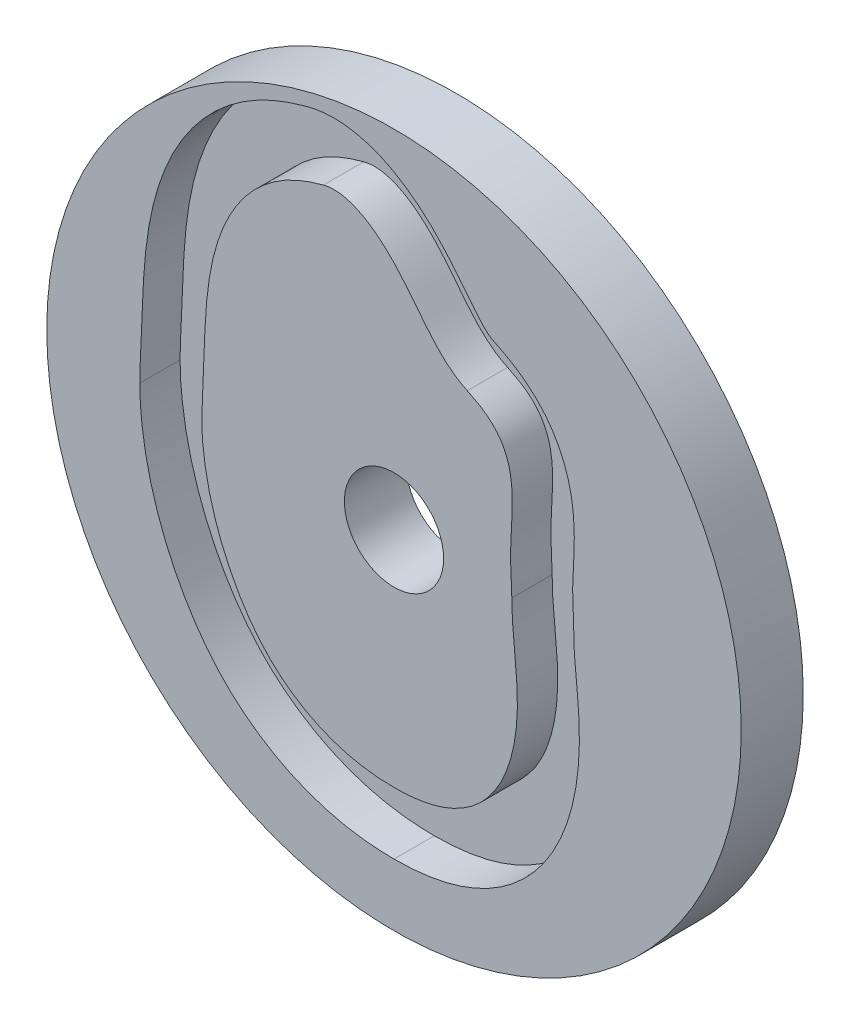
SolidWorks part; units mm, degrees
ref_plane "Front" through (0, 0, 0) normal (0, 0, 1) x (1, 0, 0)
ref_plane "Top" through (0, 0, 0) normal (0, 1, 0) x (1, 0, 0)
ref_plane "Right" through (0, 0, 0) normal (1, 0, 0) x (0, 0, -1)
sketch "Sketch1" plane through (0, 0, 0) normal (0, 0, 1) x (1, 0, 0)
  circle A0 centre (0, 0) radius 177.8
  circle A1 centre (0, 0) radius 25.4
  dimension "D1" = 355.6
  dimension "D2" = 50.8
extrude "Extrude1" add sketch "Sketch1" against normal blind 31.75
sketch "Profile1Sketch" plane through (0, 0, 0) normal (0, 0, 1) x (1, 0, 0)
  line L0 (92.075, 0) -> (60.325, 0)
  line L1 (50.947, 109.2563) -> (37.5289, 80.481)
  point P2 (92.0595, 1.738)
  point P3 (92.023, 3.2668)
  point P4 (91.9714, 4.7476)
  point P5 (91.9097, 6.1821)
  point P6 (91.8427, 7.5727)
  point P7 (91.7742, 8.9228)
  point P8 (91.7078, 10.2366)
  point P9 (91.646, 11.519)
  point P10 (91.5912, 12.776)
  point P11 (91.545, 14.0138)
  point P12 (91.5088, 15.2398)
  point P13 (91.4836, 16.4613)
  point P14 (91.4702, 17.6861)
  point P15 (91.4691, 18.9222)
  point P16 (91.4806, 20.1771)
  point P17 (91.5048, 21.4582)
  point P18 (91.5414, 22.7723)
  point P19 (91.5899, 24.1255)
  point P20 (91.6495, 25.523)
  point P21 (91.7188, 26.9694)
  point P22 (91.796, 28.4683)
  point P23 (91.8788, 30.0225)
  point P24 (91.9644, 31.6339)
  point P25 (92.0495, 33.3038)
  point P26 (92.1301, 35.0326)
  point P27 (92.2021, 36.8201)
  point P28 (92.2607, 38.6657)
  point P29 (92.301, 40.5678)
  point P30 (92.3175, 42.5247)
  point P31 (92.3048, 44.5339)
  point P32 (92.2571, 46.5927)
  point P33 (92.1687, 48.6978)
  point P34 (92.0337, 50.8454)
  point P35 (91.8464, 53.0315)
  point P36 (91.6011, 55.2515)
  point P37 (91.2924, 57.5005)
  point P38 (90.915, 59.7731)
  point P39 (90.4641, 62.0638)
  point P40 (89.9352, 64.3665)
  point P41 (89.3244, 66.6748)
  point P42 (88.6282, 68.9821)
  point P43 (87.844, 71.2815)
  point P44 (86.9695, 73.5658)
  point P45 (86.0037, 75.8279)
  point P46 (84.9462, 78.0604)
  point P47 (83.7975, 80.2562)
  point P48 (82.559, 82.4083)
  point P49 (81.2332, 84.5098)
  point P50 (79.8234, 86.5546)
  point P51 (78.3338, 88.5367)
  point P52 (76.7695, 90.4513)
  point P53 (75.1363, 92.2938)
  point P54 (73.4405, 94.0609)
  point P55 (71.6889, 95.75)
  point P56 (69.8887, 97.3596)
  point P57 (68.0473, 98.8889)
  point P58 (66.1719, 100.3383)
  point P59 (64.27, 101.7089)
  point P60 (62.3485, 103.0028)
  point P61 (60.4143, 104.2226)
  point P62 (58.4738, 105.3717)
  point P63 (56.5327, 106.4539)
  point P64 (54.5964, 107.4738)
  point P65 (52.6697, 108.4358)
  point P67 (60.3142, 1.1877)
  point P68 (60.2872, 2.3181)
  point P69 (60.246, 3.4962)
  point P70 (60.1933, 4.7208)
  point P71 (60.1321, 5.9907)
  point P72 (60.0655, 7.3042)
  point P73 (59.997, 8.6592)
  point P74 (59.9298, 10.0534)
  point P75 (59.8675, 11.4838)
  point P76 (59.8129, 12.9471)
  point P77 (59.7689, 14.4397)
  point P78 (59.7376, 15.9578)
  point P79 (59.7208, 17.4971)
  point P80 (59.7194, 19.0538)
  point P81 (59.7338, 20.6237)
  point P82 (59.7635, 22.2031)
  point P83 (59.8076, 23.7887)
  point P84 (59.8646, 25.3775)
  point P85 (59.9323, 26.9669)
  point P86 (60.0084, 28.5548)
  point P87 (60.09, 30.1396)
  point P88 (60.1742, 31.7198)
  point P89 (60.2579, 33.2944)
  point P90 (60.3378, 34.8623)
  point P91 (60.4106, 36.4227)
  point P92 (60.4731, 37.9747)
  point P93 (60.5222, 39.5173)
  point P94 (60.5546, 41.0495)
  point P95 (60.5675, 42.57)
  point P96 (60.558, 44.0775)
  point P97 (60.5235, 45.5704)
  point P98 (60.4616, 47.047)
  point P99 (60.37, 48.5053)
  point P100 (60.2469, 49.9434)
  point P101 (60.0906, 51.3592)
  point P102 (59.8997, 52.7506)
  point P103 (59.6731, 54.1157)
  point P104 (59.4101, 55.4525)
  point P105 (59.11, 56.7593)
  point P106 (58.7727, 58.0345)
  point P107 (58.3979, 59.277)
  point P108 (57.9857, 60.4858)
  point P109 (57.5362, 61.6603)
  point P110 (57.0495, 62.8004)
  point P111 (56.5257, 63.9062)
  point P112 (55.9649, 64.9784)
  point P113 (55.3669, 66.0176)
  point P114 (54.7313, 67.0251)
  point P115 (54.0578, 68.002)
  point P116 (53.3455, 68.9499)
  point P117 (52.5935, 69.8701)
  point P118 (51.8009, 70.7643)
  point P119 (50.9665, 71.6337)
  point P120 (50.0891, 72.4797)
  point P121 (49.1675, 73.3035)
  point P122 (48.2007, 74.1063)
  point P123 (47.1877, 74.8891)
  point P124 (46.1279, 75.6527)
  point P125 (45.0207, 76.3981)
  point P126 (43.8659, 77.1263)
  point P127 (42.6635, 77.8381)
  point P128 (41.4138, 78.5348)
  point P129 (40.1174, 79.2174)
  point P130 (38.7752, 79.8874)
extrude "Cycloidal  0.0  65.0  76.200  104.676" cut sketch "Profile1Sketch" against normal blind 20.6502
sketch "Profile2Sketch" plane through (0, 0, 0) normal (0, 0, 1) x (1, 0, 0)
  line L0 (50.947, 109.2563) -> (37.5289, 80.481)
  line L1 (-44.3489, 165.5123) -> (-36.1314, 134.8442)
  point P2 (50.2105, 109.6342)
  point P3 (49.5194, 110.0527)
  point P4 (48.7756, 110.5706)
  point P5 (47.9577, 111.2146)
  point P6 (47.0537, 112.0067)
  point P7 (46.0586, 112.9626)
  point P8 (44.9718, 114.0908)
  point P9 (43.795, 115.3931)
  point P10 (42.5301, 116.8661)
  point P11 (41.1785, 118.5021)
  point P12 (39.7405, 120.2904)
  point P13 (38.2155, 122.2182)
  point P14 (36.6019, 124.2711)
  point P15 (34.8971, 126.4338)
  point P16 (33.0983, 128.6904)
  point P17 (31.2021, 131.0244)
  point P18 (29.2052, 133.4189)
  point P19 (27.1043, 135.857)
  point P20 (24.8963, 138.3214)
  point P21 (22.5783, 140.7948)
  point P22 (20.148, 143.2597)
  point P23 (17.6035, 145.6987)
  point P24 (14.9434, 148.0943)
  point P25 (12.167, 150.4289)
  point P26 (9.274, 152.6849)
  point P27 (6.2651, 154.8448)
  point P28 (3.1416, 156.8909)
  point P29 (-0.0942, 158.8054)
  point P30 (-3.4388, 160.5706)
  point P31 (-6.8878, 162.1685)
  point P32 (-10.435, 163.5815)
  point P33 (-14.0726, 164.7919)
  point P34 (-17.7906, 165.7824)
  point P35 (-21.5767, 166.5366)
  point P36 (-25.4162, 167.0393)
  point P37 (-29.2917, 167.2769)
  point P38 (-33.1832, 167.2386)
  point P39 (-37.0686, 166.9165)
  point P40 (-40.9243, 166.3068)
  point P42 (34.6835, 81.9398)
  point P43 (32.2127, 83.4343)
  point P44 (29.8689, 85.0638)
  point P45 (27.6576, 86.8022)
  point P46 (25.5741, 88.6253)
  point P47 (23.6068, 90.5131)
  point P48 (21.7392, 92.4504)
  point P49 (19.9529, 94.4261)
  point P50 (18.2295, 96.4323)
  point P51 (16.5514, 98.4629)
  point P52 (14.9028, 100.5129)
  point P53 (13.2695, 102.5774)
  point P54 (11.6396, 104.6511)
  point P55 (10.0027, 106.7277)
  point P56 (8.3505, 108.8005)
  point P57 (6.6762, 110.8615)
  point P58 (4.9746, 112.9021)
  point P59 (3.2422, 114.9128)
  point P60 (1.4766, 116.8836)
  point P61 (-0.3229, 118.8039)
  point P62 (-2.1556, 120.663)
  point P63 (-4.0197, 122.4501)
  point P64 (-5.912, 124.1545)
  point P65 (-7.8282, 125.766)
  point P66 (-9.7626, 127.2749)
  point P67 (-11.7089, 128.6723)
  point P68 (-13.6596, 129.9505)
  point P69 (-15.6067, 131.103)
  point P70 (-17.5418, 132.1247)
  point P71 (-19.4563, 133.0121)
  point P72 (-21.342, 133.7637)
  point P73 (-23.1912, 134.3795)
  point P74 (-24.9974, 134.8612)
  point P75 (-26.7556, 135.2119)
  point P76 (-28.4628, 135.4358)
  point P77 (-30.1182, 135.5376)
  point P78 (-31.7231, 135.5221)
  point P79 (-33.2811, 135.3933)
  point P80 (-34.7973, 135.1536)
extrude "Harmonic  65.0  105.0  104.676  155.476" cut sketch "Profile2Sketch" against normal blind 20.6502
sketch "Profile3Sketch" plane through (0, 0, 0) normal (0, 0, 1) x (1, 0, 0)
  line L0 (-44.3489, 165.5123) -> (-36.1314, 134.8442)
  line L1 (-130.175, 0) -> (-98.425, 0)
  point P2 (-47.5406, 164.6224)
  point P3 (-50.4636, 163.7405)
  point P4 (-53.4011, 162.7814)
  point P5 (-56.346, 161.7382)
  point P6 (-59.29, 160.6053)
  point P7 (-62.224, 159.3786)
  point P8 (-65.1381, 158.0555)
  point P9 (-68.0223, 156.6354)
  point P10 (-70.8668, 155.1198)
  point P11 (-73.6623, 153.5115)
  point P12 (-76.4038, 151.8139)
  point P13 (-79.0875, 150.0291)
  point P14 (-81.7102, 148.1595)
  point P15 (-84.2689, 146.2081)
  point P16 (-86.7606, 144.1779)
  point P17 (-89.1826, 142.072)
  point P18 (-91.5327, 139.8941)
  point P19 (-93.8085, 137.6476)
  point P20 (-96.0083, 135.3364)
  point P21 (-98.1303, 132.9645)
  point P22 (-100.1733, 130.5357)
  point P23 (-102.1361, 128.0543)
  point P24 (-104.0178, 125.5245)
  point P25 (-105.8181, 122.9504)
  point P26 (-107.5365, 120.3365)
  point P27 (-109.1732, 117.6869)
  point P28 (-110.7283, 115.006)
  point P29 (-112.2024, 112.298)
  point P30 (-113.5964, 109.5672)
  point P31 (-114.9111, 106.8177)
  point P32 (-116.1479, 104.0536)
  point P33 (-117.3083, 101.279)
  point P34 (-118.3939, 98.4977)
  point P35 (-119.4066, 95.7135)
  point P36 (-120.3486, 92.9302)
  point P37 (-121.222, 90.1511)
  point P38 (-122.0292, 87.3798)
  point P39 (-122.7729, 84.6194)
  point P40 (-123.4557, 81.873)
  point P41 (-124.0805, 79.1435)
  point P42 (-124.65, 76.4336)
  point P43 (-125.1673, 73.7457)
  point P44 (-125.6355, 71.0822)
  point P45 (-126.0576, 68.4453)
  point P46 (-126.4367, 65.8367)
  point P47 (-126.7761, 63.2582)
  point P48 (-127.0787, 60.7112)
  point P49 (-127.3479, 58.197)
  point P50 (-127.5865, 55.7165)
  point P51 (-127.7977, 53.2706)
  point P52 (-127.9845, 50.8597)
  point P53 (-128.1496, 48.4841)
  point P54 (-128.2959, 46.1439)
  point P55 (-128.4259, 43.8389)
  point P56 (-128.5423, 41.5686)
  point P57 (-128.6475, 39.3323)
  point P58 (-128.7435, 37.129)
  point P59 (-128.8326, 34.9576)
  point P60 (-128.9166, 32.8165)
  point P61 (-128.9973, 30.704)
  point P62 (-129.0763, 28.6183)
  point P63 (-129.1548, 26.5571)
  point P64 (-129.2342, 24.5182)
  point P65 (-129.3155, 22.4989)
  point P66 (-129.3995, 20.4966)
  point P67 (-129.4866, 18.5083)
  point P68 (-129.578, 16.5273)
  point P69 (-129.673, 14.5428)
  point P70 (-129.7704, 12.5438)
  point P71 (-129.8677, 10.5204)
  point P72 (-129.9609, 8.4634)
  point P73 (-130.0451, 6.3653)
  point P74 (-130.114, 4.2198)
  point P75 (-130.1601, 2.023)
  point P77 (-38.6901, 134.1309)
  point P78 (-40.9627, 133.4454)
  point P79 (-43.1837, 132.7203)
  point P80 (-45.3533, 131.9519)
  point P81 (-47.4723, 131.1366)
  point P82 (-49.5425, 130.2711)
  point P83 (-51.5662, 129.3524)
  point P84 (-53.5461, 128.3777)
  point P85 (-55.4855, 127.3443)
  point P86 (-57.3875, 126.2499)
  point P87 (-59.2525, 125.095)
  point P88 (-61.079, 123.8803)
  point P89 (-62.8655, 122.6068)
  point P90 (-64.6108, 121.2758)
  point P91 (-66.3133, 119.8885)
  point P92 (-67.9721, 118.4463)
  point P93 (-69.5858, 116.9508)
  point P94 (-71.1533, 115.4034)
  point P95 (-72.6738, 113.8059)
  point P96 (-74.1461, 112.1602)
  point P97 (-75.5695, 110.4679)
  point P98 (-76.9433, 108.7311)
  point P99 (-78.2668, 106.9517)
  point P100 (-79.5395, 105.132)
  point P101 (-80.7609, 103.2739)
  point P102 (-81.9309, 101.3798)
  point P103 (-83.0492, 99.4519)
  point P104 (-84.1159, 97.4923)
  point P105 (-85.131, 95.5036)
  point P106 (-86.0949, 93.4878)
  point P107 (-87.0078, 91.4475)
  point P108 (-87.8704, 89.3848)
  point P109 (-88.6833, 87.302)
  point P110 (-89.4473, 85.2014)
  point P111 (-90.1635, 83.0852)
  point P112 (-90.8328, 80.9555)
  point P113 (-91.4565, 78.8143)
  point P114 (-92.0359, 76.6636)
  point P115 (-92.5724, 74.5053)
  point P116 (-93.0677, 72.3412)
  point P117 (-93.5234, 70.1729)
  point P118 (-93.9412, 68.0019)
  point P119 (-94.3229, 65.8298)
  point P120 (-94.6706, 63.6578)
  point P121 (-94.9861, 61.4871)
  point P122 (-95.2714, 59.3186)
  point P123 (-95.5287, 57.1534)
  point P124 (-95.76, 54.9921)
  point P125 (-95.9675, 52.8355)
  point P126 (-96.1533, 50.684)
  point P127 (-96.3195, 48.5382)
  point P128 (-96.4682, 46.3982)
  point P129 (-96.6016, 44.2642)
  point P130 (-96.7216, 42.1366)
  point P131 (-96.8304, 40.0151)
  point P132 (-96.9298, 37.9)
  point P133 (-97.0217, 35.7911)
  point P134 (-97.108, 33.6884)
  point P135 (-97.1903, 31.5918)
  point P136 (-97.2701, 29.5011)
  point P137 (-97.349, 27.4163)
  point P138 (-97.4283, 25.3373)
  point P139 (-97.509, 23.2641)
  point P140 (-97.5922, 21.1966)
  point P141 (-97.6788, 19.1349)
  point P142 (-97.7688, 17.0789)
  point P143 (-97.8632, 15.0327)
  point P144 (-97.9603, 13.0039)
  point P145 (-98.058, 10.9999)
  point P146 (-98.1528, 9.0278)
  point P147 (-98.2405, 7.0938)
  point P148 (-98.3164, 5.203)
  point P149 (-98.3756, 3.36)
  point P150 (-98.4133, 1.5677)
extrude "Sine(Mod)  105.0  180.0  155.476  114.300" cut sketch "Profile3Sketch" against normal blind 20.6502
sketch "Profile4Sketch" plane through (0, 0, 0) normal (0, 0, 1) x (1, 0, 0)
  line L0 (-130.175, 0) -> (-98.425, 0)
  line L1 (0, -145.9509) -> (0, -114.2009)
  point P2 (-130.1514, -2.4925)
  point P3 (-130.0905, -4.7469)
  point P4 (-129.9937, -6.99)
  point P5 (-129.8628, -9.2219)
  point P6 (-129.6994, -11.4429)
  point P7 (-129.5048, -13.6538)
  point P8 (-129.2802, -15.8554)
  point P9 (-129.0266, -18.0488)
  point P10 (-128.7445, -20.2351)
  point P11 (-128.4346, -22.4156)
  point P12 (-128.0968, -24.5918)
  point P13 (-127.731, -26.7647)
  point P14 (-127.3373, -28.9345)
  point P15 (-126.9157, -31.1013)
  point P16 (-126.466, -33.2648)
  point P17 (-125.9882, -35.4249)
  point P18 (-125.4821, -37.5814)
  point P19 (-124.9478, -39.7342)
  point P20 (-124.3851, -41.8832)
  point P21 (-123.7939, -44.028)
  point P22 (-123.1741, -46.1687)
  point P23 (-122.5257, -48.305)
  point P24 (-121.8485, -50.4367)
  point P25 (-121.1425, -52.5636)
  point P26 (-120.4074, -54.6856)
  point P27 (-119.6432, -56.8024)
  point P28 (-118.8497, -58.9139)
  point P29 (-118.0269, -61.0197)
  point P30 (-117.1745, -63.1197)
  point P31 (-116.2925, -65.2136)
  point P32 (-115.3807, -67.3012)
  point P33 (-114.439, -69.3823)
  point P34 (-113.4671, -71.4565)
  point P35 (-112.4651, -73.5237)
  point P36 (-111.4324, -75.5839)
  point P37 (-110.3681, -77.638)
  point P38 (-109.2711, -79.6865)
  point P39 (-108.1402, -81.7297)
  point P40 (-106.974, -83.7679)
  point P41 (-105.771, -85.8006)
  point P42 (-104.5299, -87.8275)
  point P43 (-103.2491, -89.8476)
  point P44 (-101.9272, -91.8598)
  point P45 (-100.5627, -93.8626)
  point P46 (-99.1546, -95.8544)
  point P47 (-97.7017, -97.8331)
  point P48 (-96.2031, -99.7965)
  point P49 (-94.6582, -101.7422)
  point P50 (-93.0666, -103.6677)
  point P51 (-91.428, -105.5703)
  point P52 (-89.7426, -107.4474)
  point P53 (-88.011, -109.2961)
  point P54 (-86.2338, -111.1139)
  point P55 (-84.4121, -112.8983)
  point P56 (-82.5471, -114.6468)
  point P57 (-80.6405, -116.3571)
  point P58 (-78.694, -118.0275)
  point P59 (-76.7088, -119.6568)
  point P60 (-74.6858, -121.2439)
  point P61 (-72.6262, -122.7881)
  point P62 (-70.5309, -124.2885)
  point P63 (-68.4009, -125.7442)
  point P64 (-66.2374, -127.1545)
  point P65 (-64.0414, -128.5185)
  point P66 (-61.814, -129.8354)
  point P67 (-59.5564, -131.1046)
  point P68 (-57.2697, -132.3253)
  point P69 (-54.9551, -133.4969)
  point P70 (-52.6137, -134.6187)
  point P71 (-50.2467, -135.69)
  point P72 (-47.8553, -136.7104)
  point P73 (-45.4408, -137.6791)
  point P74 (-43.0043, -138.5958)
  point P75 (-40.5472, -139.4597)
  point P76 (-38.0706, -140.2706)
  point P77 (-35.5758, -141.028)
  point P78 (-33.0641, -141.7313)
  point P79 (-30.5368, -142.3803)
  point P80 (-27.9951, -142.9746)
  point P81 (-25.441, -143.5138)
  point P82 (-22.8768, -143.9975)
  point P83 (-20.3053, -144.4258)
  point P84 (-17.7289, -144.7989)
  point P85 (-15.1502, -145.1176)
  point P86 (-12.5715, -145.3826)
  point P87 (-9.9949, -145.5952)
  point P88 (-7.4224, -145.7567)
  point P89 (-4.8557, -145.8686)
  point P90 (-2.2963, -145.9327)
  point P92 (-98.407, -1.896)
  point P93 (-98.3601, -3.63)
  point P94 (-98.2849, -5.3731)
  point P95 (-98.1822, -7.1246)
  point P96 (-98.0528, -8.8834)
  point P97 (-97.8974, -10.6485)
  point P98 (-97.7168, -12.4185)
  point P99 (-97.5117, -14.1924)
  point P100 (-97.2825, -15.9686)
  point P101 (-97.0299, -17.7457)
  point P102 (-96.7541, -19.5222)
  point P103 (-96.4553, -21.2967)
  point P104 (-96.1339, -23.0688)
  point P105 (-95.7895, -24.8384)
  point P106 (-95.4223, -26.6052)
  point P107 (-95.0321, -28.3693)
  point P108 (-94.6188, -30.1305)
  point P109 (-94.1824, -31.8886)
  point P110 (-93.7229, -33.6435)
  point P111 (-93.2401, -35.3951)
  point P112 (-92.734, -37.1433)
  point P113 (-92.2044, -38.8879)
  point P114 (-91.6514, -40.6287)
  point P115 (-91.0748, -42.3657)
  point P116 (-90.4745, -44.0987)
  point P117 (-89.8504, -45.8274)
  point P118 (-89.2024, -47.5518)
  point P119 (-88.5304, -49.2716)
  point P120 (-87.8342, -50.9867)
  point P121 (-87.1138, -52.6969)
  point P122 (-86.3691, -54.402)
  point P123 (-85.5999, -56.1018)
  point P124 (-84.806, -57.7961)
  point P125 (-83.9876, -59.4848)
  point P126 (-83.1443, -61.1669)
  point P127 (-82.2769, -62.8411)
  point P128 (-81.3854, -64.5059)
  point P129 (-80.4701, -66.1596)
  point P130 (-79.5311, -67.8007)
  point P131 (-78.5684, -69.4276)
  point P132 (-77.5818, -71.0387)
  point P133 (-76.5713, -72.6326)
  point P134 (-75.5365, -74.2077)
  point P135 (-74.4771, -75.7628)
  point P136 (-73.3929, -77.2965)
  point P137 (-72.2834, -78.8076)
  point P138 (-71.1482, -80.295)
  point P139 (-69.9868, -81.7577)
  point P140 (-68.7988, -83.1948)
  point P141 (-67.5838, -84.6056)
  point P142 (-66.3413, -85.9896)
  point P143 (-65.0707, -87.346)
  point P144 (-63.7718, -88.6747)
  point P145 (-62.4439, -89.9753)
  point P146 (-61.0868, -91.2476)
  point P147 (-59.7001, -92.4917)
  point P148 (-58.2834, -93.7073)
  point P149 (-56.8374, -94.8941)
  point P150 (-55.3626, -96.0512)
  point P151 (-53.8599, -97.1778)
  point P152 (-52.3299, -98.2734)
  point P153 (-50.7735, -99.3371)
  point P154 (-49.1915, -100.3683)
  point P155 (-47.5847, -101.3663)
  point P156 (-45.9538, -102.3306)
  point P157 (-44.2999, -103.2604)
  point P158 (-42.6236, -104.1553)
  point P159 (-40.9259, -105.0146)
  point P160 (-39.2077, -105.8378)
  point P161 (-37.4699, -106.6243)
  point P162 (-35.7134, -107.3738)
  point P163 (-33.9391, -108.0857)
  point P164 (-32.1479, -108.7595)
  point P165 (-30.3409, -109.3949)
  point P166 (-28.519, -109.9914)
  point P167 (-26.6832, -110.5487)
  point P168 (-24.8343, -111.0665)
  point P169 (-22.9735, -111.5443)
  point P170 (-21.1018, -111.982)
  point P171 (-19.2195, -112.3793)
  point P172 (-17.3267, -112.7364)
  point P173 (-15.4229, -113.0534)
  point P174 (-13.5082, -113.3307)
  point P175 (-11.5824, -113.5687)
  point P176 (-9.6456, -113.7677)
  point P177 (-7.6977, -113.9284)
  point P178 (-5.7389, -114.0513)
  point P179 (-3.7696, -114.1372)
  point P180 (-1.79, -114.1867)
extrude "Trap(Mod)  180.0  270.0  114.300  130.076" cut sketch "Profile4Sketch" against normal blind 20.6502
sketch "Profile5Sketch" plane through (0, 0, 0) normal (0, 0, 1) x (1, 0, 0)
  line L0 (0, -145.9509) -> (0, -114.2009)
  line L1 (92.075, 0) -> (60.325, 0)
  point P2 (2.8128, -145.9233)
  point P3 (5.3875, -145.8475)
  point P4 (7.978, -145.7198)
  point P5 (10.5825, -145.5367)
  point P6 (13.1992, -145.2947)
  point P7 (15.826, -144.9905)
  point P8 (18.4605, -144.6207)
  point P9 (21.0999, -144.1822)
  point P10 (23.7413, -143.6721)
  point P11 (26.3814, -143.0876)
  point P12 (29.0168, -142.4262)
  point P13 (31.6439, -141.6857)
  point P14 (34.2587, -140.8642)
  point P15 (36.8572, -139.9602)
  point P16 (39.4353, -138.9724)
  point P17 (41.9887, -137.8999)
  point P18 (44.5131, -136.7424)
  point P19 (47.0041, -135.4998)
  point P20 (49.4574, -134.1726)
  point P21 (51.8686, -132.7614)
  point P22 (54.2337, -131.2676)
  point P23 (56.5484, -129.6928)
  point P24 (58.8089, -128.0391)
  point P25 (61.0115, -126.3088)
  point P26 (63.1528, -124.5048)
  point P27 (65.2294, -122.6302)
  point P28 (67.2386, -120.6885)
  point P29 (69.1777, -118.6833)
  point P30 (71.0444, -116.6187)
  point P31 (72.8369, -114.4988)
  point P32 (74.5536, -112.328)
  point P33 (76.1933, -110.1108)
  point P34 (77.7552, -107.8519)
  point P35 (79.2388, -105.5559)
  point P36 (80.6439, -103.2277)
  point P37 (81.9708, -100.8721)
  point P38 (83.2201, -98.4937)
  point P39 (84.3927, -96.0974)
  point P40 (85.4897, -93.6879)
  point P41 (86.5127, -91.2699)
  point P42 (87.4634, -88.8477)
  point P43 (88.3439, -86.4259)
  point P44 (89.1564, -84.0087)
  point P45 (89.9033, -81.6002)
  point P46 (90.5875, -79.2044)
  point P47 (91.2127, -76.8201)
  point P48 (91.7816, -74.4465)
  point P49 (92.2959, -72.086)
  point P50 (92.7574, -69.7408)
  point P51 (93.168, -67.4131)
  point P52 (93.5297, -65.1049)
  point P53 (93.8444, -62.8181)
  point P54 (94.1142, -60.5546)
  point P55 (94.3414, -58.3162)
  point P56 (94.528, -56.1045)
  point P57 (94.6763, -53.9211)
  point P58 (94.7887, -51.7674)
  point P59 (94.8674, -49.6447)
  point P60 (94.9148, -47.5542)
  point P61 (94.9332, -45.4972)
  point P62 (94.925, -43.4745)
  point P63 (94.8926, -41.4872)
  point P64 (94.8383, -39.536)
  point P65 (94.7645, -37.6215)
  point P66 (94.6735, -35.7444)
  point P67 (94.5676, -33.9051)
  point P68 (94.449, -32.1039)
  point P69 (94.32, -30.3411)
  point P70 (94.1827, -28.6168)
  point P71 (94.0391, -26.931)
  point P72 (93.8912, -25.2834)
  point P73 (93.7409, -23.6739)
  point P74 (93.59, -22.102)
  point P75 (93.4402, -20.5671)
  point P76 (93.293, -19.0685)
  point P77 (93.1499, -17.6053)
  point P78 (93.0122, -16.1764)
  point P79 (92.881, -14.7806)
  point P80 (92.7574, -13.4164)
  point P81 (92.6423, -12.0822)
  point P82 (92.5365, -10.7762)
  point P83 (92.4406, -9.4963)
  point P84 (92.3551, -8.2401)
  point P85 (92.2805, -7.0053)
  point P86 (92.2172, -5.7891)
  point P87 (92.1652, -4.5888)
  point P88 (92.125, -3.4012)
  point P89 (92.0965, -2.2233)
  point P90 (92.0798, -1.0517)
  point P92 (2.1815, -114.1795)
  point P93 (4.1451, -114.1218)
  point P94 (6.0894, -114.026)
  point P95 (8.0135, -113.8908)
  point P96 (9.9168, -113.7149)
  point P97 (11.7983, -113.497)
  point P98 (13.6573, -113.2361)
  point P99 (15.4928, -112.9313)
  point P100 (17.3039, -112.5815)
  point P101 (19.0898, -112.1862)
  point P102 (20.8495, -111.7446)
  point P103 (22.5822, -111.2563)
  point P104 (24.287, -110.7208)
  point P105 (25.9631, -110.1377)
  point P106 (27.6096, -109.5069)
  point P107 (29.2257, -108.8281)
  point P108 (30.8107, -108.1014)
  point P109 (32.3639, -107.3267)
  point P110 (33.8844, -106.5041)
  point P111 (35.3716, -105.6337)
  point P112 (36.8248, -104.7159)
  point P113 (38.2433, -103.7509)
  point P114 (39.6263, -102.7391)
  point P115 (40.9732, -101.681)
  point P116 (42.2834, -100.5772)
  point P117 (43.556, -99.4284)
  point P118 (44.7904, -98.2354)
  point P119 (45.986, -96.9991)
  point P120 (47.142, -95.7204)
  point P121 (48.2579, -94.4007)
  point P122 (49.333, -93.0412)
  point P123 (50.3667, -91.6433)
  point P124 (51.3587, -90.2085)
  point P125 (52.3085, -88.7386)
  point P126 (53.2157, -87.2353)
  point P127 (54.0802, -85.7005)
  point P128 (54.9018, -84.1363)
  point P129 (55.6806, -82.5447)
  point P130 (56.4167, -80.9279)
  point P131 (57.1104, -79.2881)
  point P132 (57.7621, -77.6275)
  point P133 (58.3725, -75.9484)
  point P134 (58.9423, -74.253)
  point P135 (59.4724, -72.5436)
  point P136 (59.9639, -70.8224)
  point P137 (60.4165, -69.096)
  point P138 (60.8304, -67.3693)
  point P139 (61.2064, -65.6437)
  point P140 (61.5455, -63.9205)
  point P141 (61.8488, -62.2011)
  point P142 (62.1174, -60.4865)
  point P143 (62.3525, -58.7779)
  point P144 (62.5554, -57.0762)
  point P145 (62.7272, -55.3824)
  point P146 (62.8694, -53.6974)
  point P147 (62.9832, -52.0217)
  point P148 (63.0701, -50.3561)
  point P149 (63.1314, -48.7009)
  point P150 (63.1687, -47.0568)
  point P151 (63.1833, -45.4238)
  point P152 (63.1767, -43.8023)
  point P153 (63.1504, -42.1923)
  point P154 (63.1059, -40.5937)
  point P155 (63.0447, -39.0065)
  point P156 (62.9683, -37.4305)
  point P157 (62.8782, -35.8653)
  point P158 (62.7758, -34.3104)
  point P159 (62.6627, -32.7655)
  point P160 (62.5404, -31.2299)
  point P161 (62.4103, -29.7029)
  point P162 (62.2739, -28.1838)
  point P163 (62.1328, -26.6719)
  point P164 (61.9882, -25.1663)
  point P165 (61.8418, -23.6662)
  point P166 (61.6949, -22.1706)
  point P167 (61.549, -20.6788)
  point P168 (61.4055, -19.19)
  point P169 (61.2658, -17.7032)
  point P170 (61.1312, -16.2179)
  point P171 (61.0032, -14.7332)
  point P172 (60.8829, -13.2486)
  point P173 (60.7716, -11.7637)
  point P174 (60.6706, -10.278)
  point P175 (60.5808, -8.7914)
  point P176 (60.5033, -7.3036)
  point P177 (60.4389, -5.8147)
  point P178 (60.3884, -4.3248)
  point P179 (60.3523, -2.834)
  point P180 (60.3312, -1.3425)
extrude "Cyc-Har  270.0  360.0  130.076  76.200" cut sketch "Profile5Sketch" against normal blind 20.6502
sketch "Sketch7" plane through (0, 0, 0) normal (0, 0, 1) x (1, 0, 0)
  point P0 (0, -114.2009)
  point P1 (60.325, 0)
  point P2 (-98.4211, -0.6546)
  point P3 (37.5289, 80.481)
  point P4 (-36.1314, 134.8442)
  point P5 (-98.425, 0)
  dimension "D1" = 0
surface "Surface-Extrude1" sketch "Sketch7"
